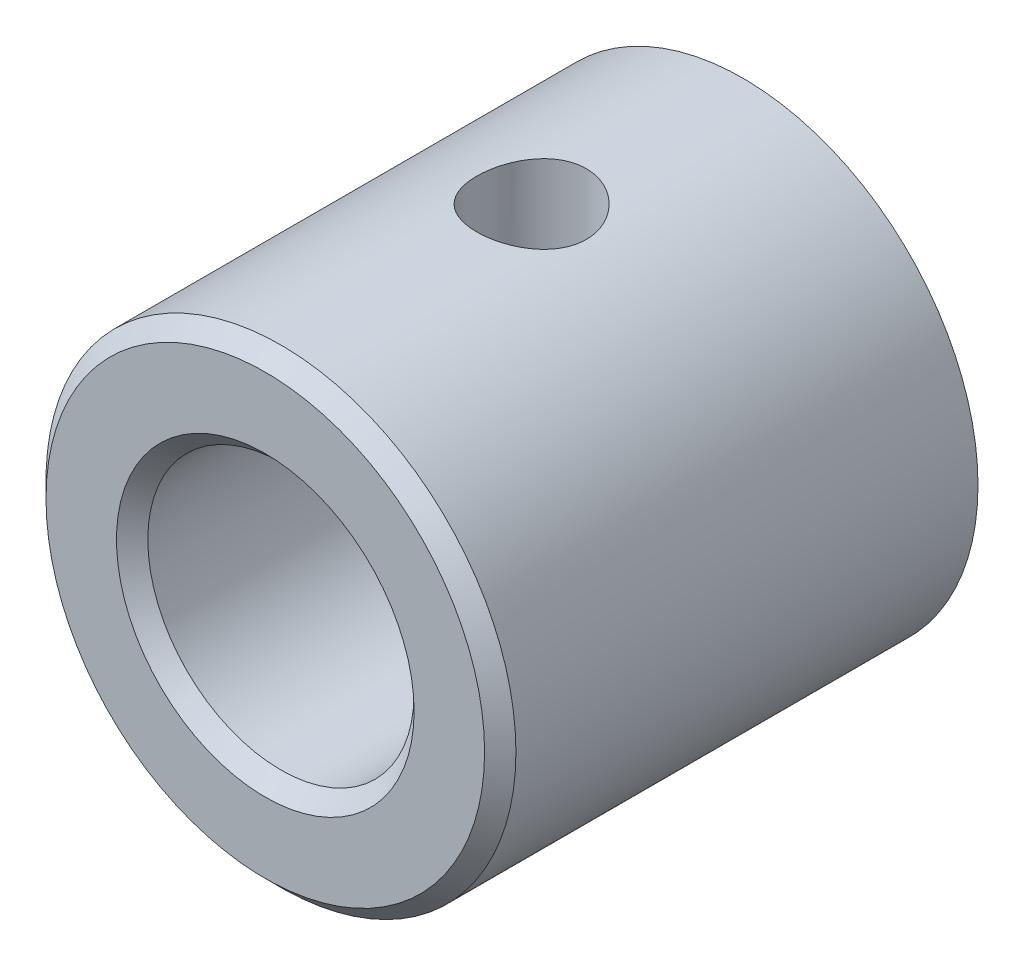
SolidWorks part; units mm, degrees
ref_plane "Face" through (0, 0, 0) normal (0, 0, 1) x (1, 0, 0)
ref_plane "Dessus" through (0, 0, 0) normal (0, 1, 0) x (1, 0, 0)
ref_plane "Droite" through (0, 0, 0) normal (1, 0, 0) x (0, 0, -1)
sketch "Esquisse1" plane through (0, 0, 0) normal (0, 0, 1) x (1, 0, 0)
  circle A0 centre (0, 0) radius 8.5
  circle A1 centre (0, 0) radius 15
  dimension "D1" = 17
  dimension "D2" = 30
extrude "Extrusion1" add sketch "Esquisse1" along normal blind 30.5
chamfer "Chanfrein1" distance 1 angle 45 2 edges at (8.5, 0, 30.5) (15, 0, 30.5)
sketch "Esquisse2" plane through (0, 0, 0) normal (0, 1, 0) x (1, 0, 0)
  line L0 (0, -29.5) -> (0, 0) construction
  line L1 (-14, -30.5) -> (14, -30.5) construction
  circle A0 centre (0, -13.5) radius 3.5
  dimension "D1" = 7
  dimension "D2" = 17
extrude "Enlèv. mat.-Extru.1" cut sketch "Esquisse2" against normal mid plane 40
